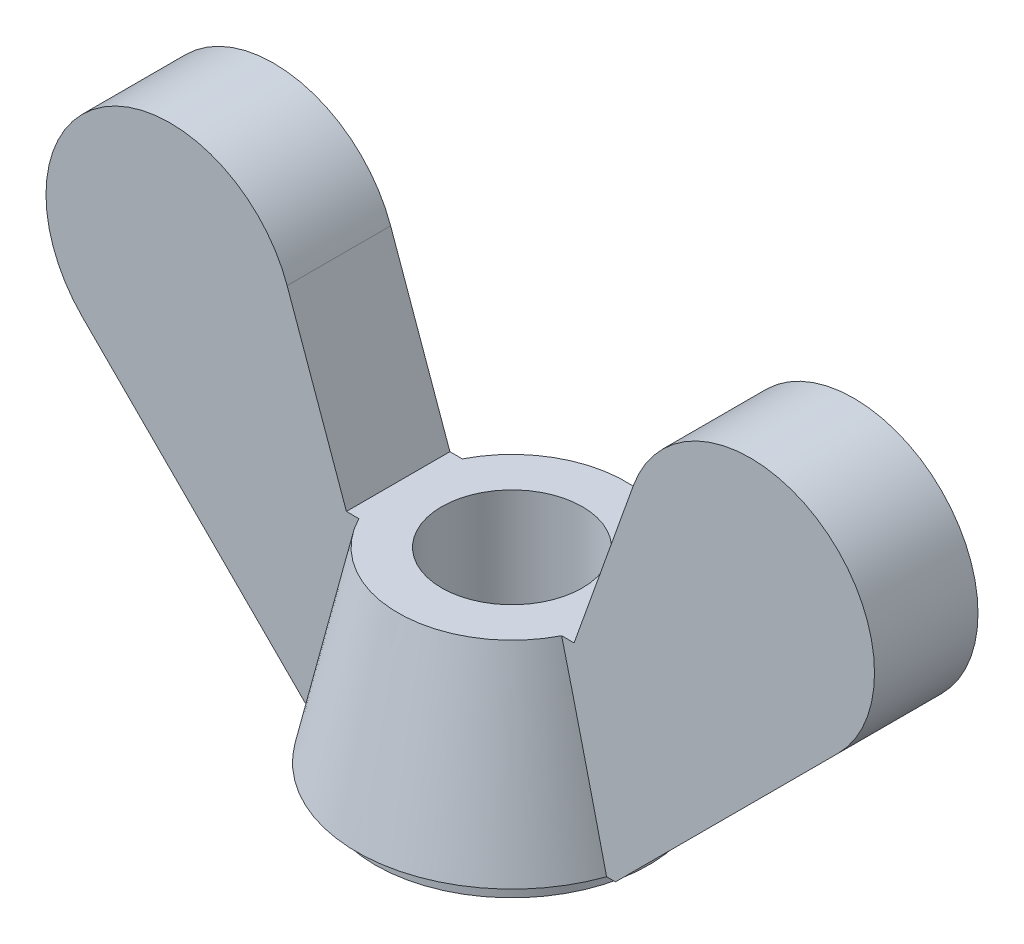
SolidWorks part; units mm, degrees
ref_plane "Plan de face" through (0, 0, 0) normal (0, 0, 1) x (1, 0, 0)
ref_plane "Plan de dessus" through (0, 0, 0) normal (0, 1, 0) x (1, 0, 0)
ref_plane "Plan de droite" through (0, 0, 0) normal (1, 0, 0) x (0, 0, -1)
imported_body "Importée3"
draft "Dépouille1" type of draft neutral plane draft angle 12.529 faces to draft 2 parameters "D1"=12.529
ref_plane "Plan1" through (0, 0, 0) normal (0, 0, -1) x (-1, 0, 0)
sketch "Esquisse1" plane through (0, 0, 0) normal (0, 0, -1) x (-1, 0, 0)
  line L0 (0, 0) -> (6.6, 0)
  line L1 (6.6, 0) -> (6.6, 1)
  line L2 (6.6, 1) -> (0, 1)
  line L3 (0, 1) -> (0, 0)
  line L4 (6.6, 0) -> (6.6, 1) construction
revolve "Révolution1" add sketch "Esquisse1" angle 360 about L4
hole_wizard "Trou taraudé M81" positions "Esquisse3" profile "Esquisse2" tap size "M8" standard "ISO"
sketch "Esquisse3" plane through (0, 0, 0) normal (0, -1, 0) x (-1, 0, 0)
  point P0 (6.6, 0)
sketch "Esquisse2" plane through (-6.6, 0, 0) normal (1, 0, 0) x (0, 0, -1)
  line L0 (0, 0) -> (0, 22)
  line L1 (0, 22) -> (3.4, 22)
  line L2 (3.4, 22) -> (3.4, 0)
  line L5 (3.4, 0) -> (0, 0)
  line L11 (0, -6.35) -> (0, 107.95) construction
  dimension "Diamètre du trou pour taraudage jusqu'au prochain" = 6.8
  dimension "Profondeur du trou pour taraudage jusqu'au prochain" = 22
